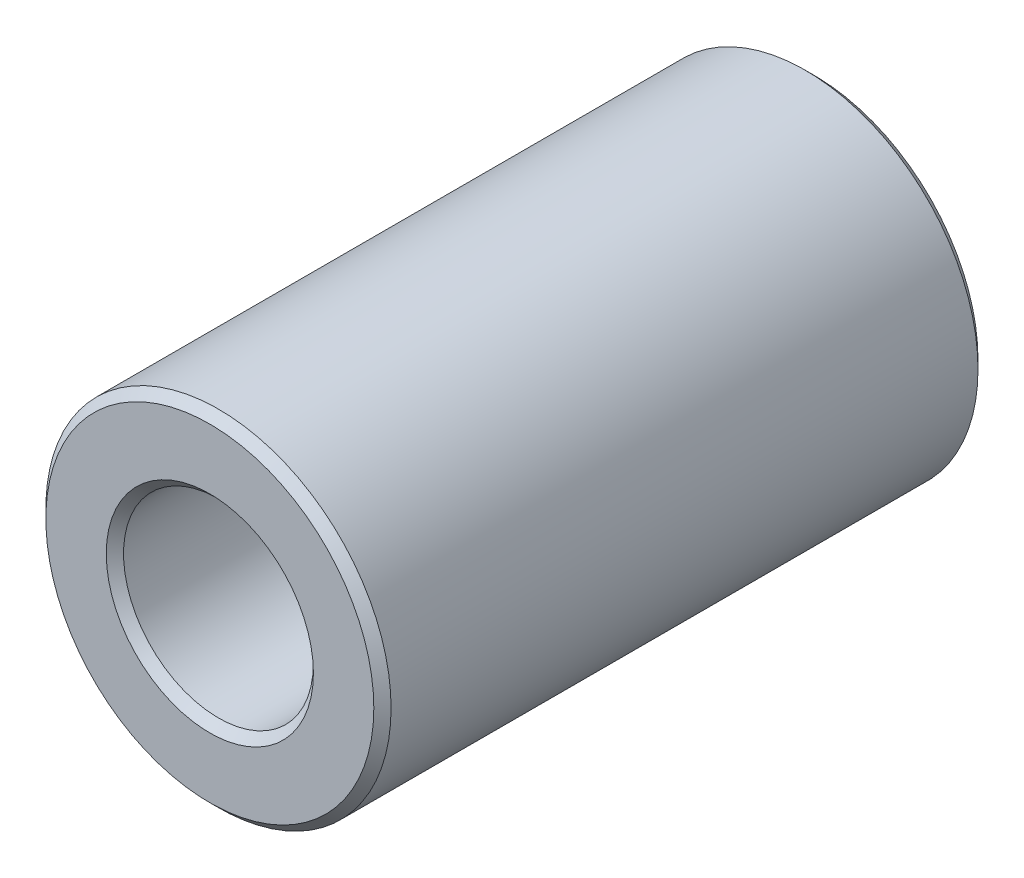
SolidWorks part; units mm, degrees
ref_plane "Front Plane" through (0, 0, 0) normal (0, 0, 1) x (1, 0, 0)
ref_plane "Top Plane" through (0, 0, 0) normal (0, 1, 0) x (1, 0, 0)
ref_plane "Right Plane" through (0, 0, 0) normal (1, 0, 0) x (0, 0, -1)
sketch "Sketch1" plane through (0, 0, 0) normal (0, 0, 1) x (1, 0, 0)
  circle A0 centre (0, 0) radius 2
  circle A1 centre (0, 0) radius 1.1
  dimension "D1" = 4
  dimension "D2" = 2.2
extrude "Boss-Extrude2" add sketch "Sketch1" along normal mid plane 7
chamfer "Chamfer3" distance 0.1 angle 45 4 edges at (2, 0, 3.5) (2, 0, -3.5) (1.1, 0, -3.5) (1.1, 0, 3.5)
